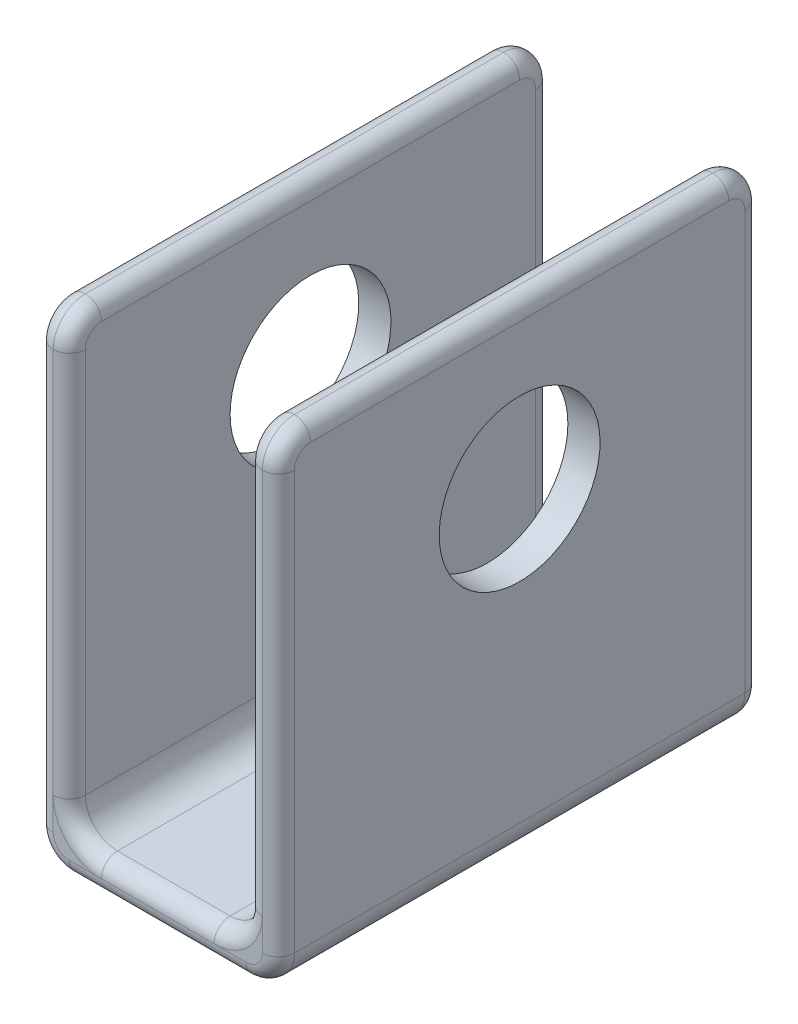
SolidWorks part; units mm, degrees
ref_plane "Front Plane" through (0, 0, 0) normal (0, 0, 1) x (1, 0, 0)
ref_plane "Top Plane" through (0, 0, 0) normal (0, 1, 0) x (1, 0, 0)
ref_plane "Right Plane" through (0, 0, 0) normal (1, 0, 0) x (0, 0, -1)
sketch "Sketch1" plane through (0, 0, 0) normal (0, 0, 1) x (1, 0, 0)
  line L0 (-9.525, 38.1) -> (-9.525, 0)
  line L1 (-9.525, 0) -> (9.525, 0)
  line L2 (9.525, 0) -> (9.525, 38.1)
  line L3 (9.525, 38.1) -> (6.985, 38.1)
  line L4 (6.985, 38.1) -> (6.985, 2.54)
  line L5 (6.985, 2.54) -> (-6.985, 2.54)
  line L6 (-6.985, 2.54) -> (-6.985, 38.1)
  line L7 (-6.985, 38.1) -> (-9.525, 38.1)
  line L8 (0, 0) -> (0, 28.6329) construction
  dimension "D1" = 38.1
  dimension "D2" = 2.54
  dimension "D3" = 19.05
  dimension "D4" = 2.54
extrude "Boss-Extrude1" add sketch "Sketch1" along normal mid plane 38.1
sketch "Sketch2" plane through (9.525, 0, 0) normal (1, 0, 0) x (0, 0, -1)
  line L0 (-19.05, 38.1) -> (19.05, 38.1) construction
  circle A0 centre (0, 25.4) radius 6.35
  dimension "D1" = 12.7
  dimension "D2" = 12.7
extrude "Cut-Extrude1" cut sketch "Sketch2" against normal through all
fillet "Fillet1" radius 2.54 4 edges at (9.525, 0, 0) (-9.525, 0, 0) (6.985, 2.54, 0) (-6.985, 2.54, 0)
fillet "Fillet3" radius 2.54 4 edges at (-8.255, 38.1, 19.05) (8.255, 38.1, 19.05) (8.255, 38.1, -19.05) (-8.255, 38.1, -19.05)
fillet "Fillet4" radius 1.27 32 edges at (-9.525, 37.3561, 18.3061) (-9.525, 19.05, 19.05) (-8.7811, 0.7439, 19.05) (0, 0, 19.05) (8.7811, 0.7439, 19.05) (9.525, 19.05, 19.05) (9.525, 37.3561, 18.3061) (9.525, 38.1, 0) (9.525, 37.3561, -18.3061) (9.525, 19.05, -19.05) (8.7811, 0.7439, -19.05) (0, 0, -19.05) (-8.7811, 0.7439, -19.05) (-9.525, 19.05, -19.05) (-9.525, 37.3561, -18.3061) (-6.985, 37.3561, 18.3061) (-6.985, 20.32, 19.05) (-6.2411, 3.2839, 19.05) (0, 2.54, 19.05) (6.2411, 3.2839, 19.05) (6.985, 20.32, 19.05) (6.985, 37.3561, 18.3061) (6.985, 38.1, 0) (6.985, 37.3561, -18.3061) (6.985, 20.32, -19.05) (6.2411, 3.2839, -19.05) (0, 2.54, -19.05) (-6.2411, 3.2839, -19.05) (-6.985, 20.32, -19.05) (-6.985, 37.3561, -18.3061) (-9.525, 38.1, 0) (-6.985, 38.1, 0)
